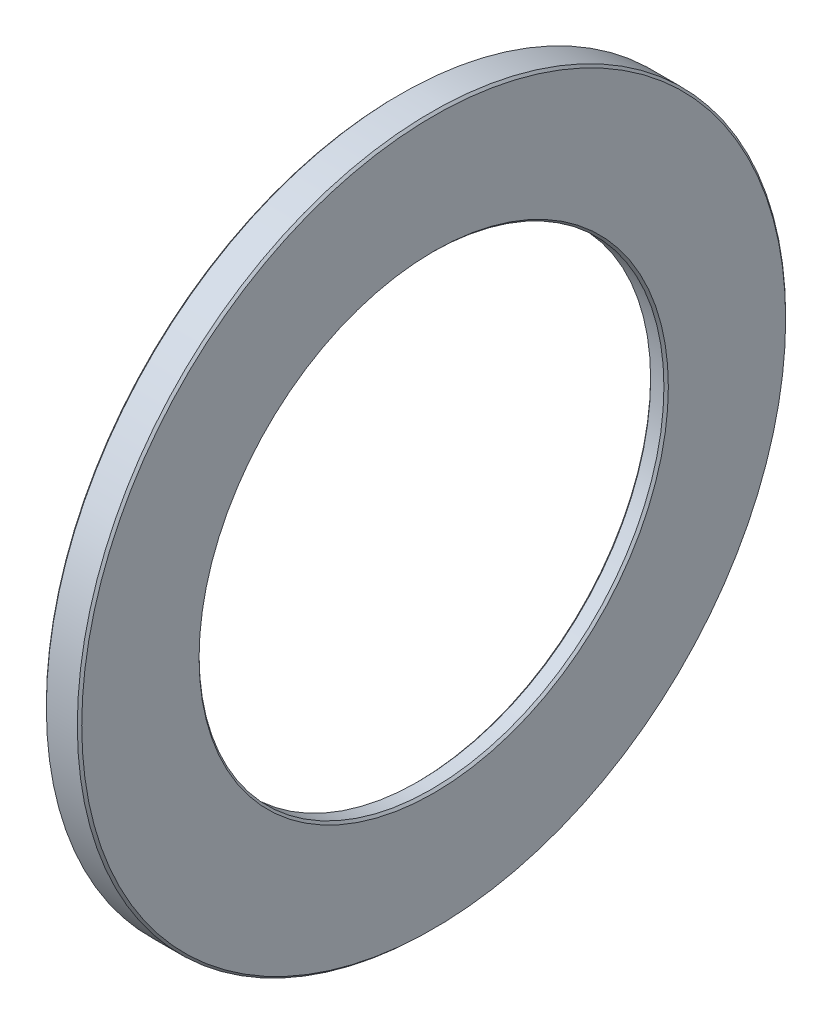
SolidWorks part; units mm, degrees
ref_plane "Plan de face" through (0, 0, 0) normal (0, 0, 1) x (1, 0, 0)
ref_plane "Plan de dessus" through (0, 0, 0) normal (0, 1, 0) x (1, 0, 0)
ref_plane "Plan de droite" through (0, 0, 0) normal (1, 0, 0) x (0, 0, -1)
sketch "Esquisse1" plane through (0, 0, 0) normal (0, 0, 1) x (1, 0, 0)
  line L0 (0, 0) -> (60.9524, 0) construction
  line L1 (0, 80) -> (0, 72.5)
  line L2 (0, 72.5) -> (4, 72.5)
  line L3 (4, 72.5) -> (4, 52.5)
  line L4 (4, 52.5) -> (8, 52.5)
  line L5 (8, 52.5) -> (8, 80)
  line L6 (8, 80) -> (0, 80)
  dimension "D1" = 4
  dimension "D2" = 8
  dimension "D3" = 105
  dimension "D4" = 160
  dimension "D5" = 145
revolve "Révolution1" add sketch "Esquisse1" angle 360 about L0
chamfer "Chanfrein1" distance 0.5 angle 45 5 edges at (8, 0, 52.5) (8, 0, 80) (4, 0, 52.5) (0, 0, 72.5) (0, 0, 80)
